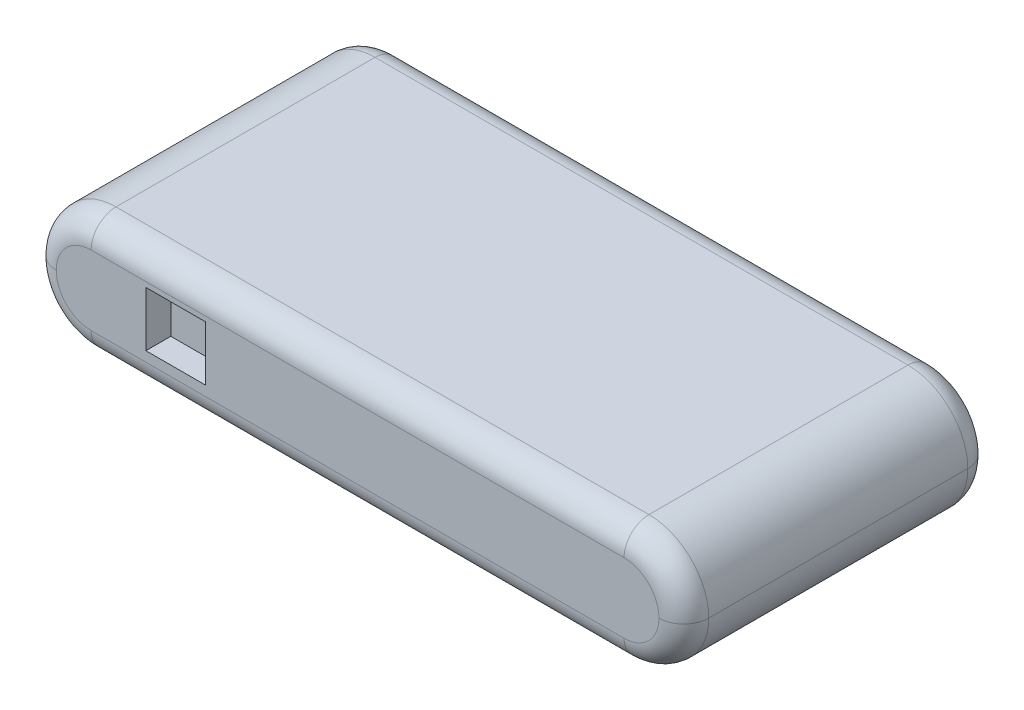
SolidWorks part; units mm, degrees
ref_plane "Front Plane" through (0, 0, 0) normal (0, 0, 1) x (1, 0, 0)
ref_plane "Top Plane" through (0, 0, 0) normal (0, 1, 0) x (1, 0, 0)
ref_plane "Right Plane" through (0, 0, 0) normal (1, 0, 0) x (0, 0, -1)
sketch "Sketch1" plane through (0, 0, 0) normal (0, 1, 0) x (1, 0, 0)
  line L1 (-65.5, -31) -> (65.5, -31)
  line L2 (-65.5, -31) -> (-65.5, 31)
  line L3 (-65.5, 31) -> (65.5, 31)
  line L4 (65.5, -31) -> (65.5, 31)
  line L5 (-65.5, -31) -> (65.5, 31) construction
  line L6 (-65.5, 31) -> (65.5, -31) construction
  point P0 (0, 0)
  dimension "D1" = 131
  dimension "D2" = 62
extrude "Boss-Extrude1" add sketch "Sketch1" along normal blind 24
fillet "Fillet2" radius 12 4 edges at (65.5, 24, 0) (65.5, 0, 0) (-65.5, 0, 0) (-65.5, 24, 0)
fillet "Fillet1" radius 5 12 edges at (0, 0, -31) (0, 0, 31) (0, 24, -31) (0, 24, 31) (61.9853, 20.4853, -31) (61.9853, 3.5147, -31) (-61.9853, 3.5147, -31) (-61.9853, 20.4853, -31) (-61.9853, 20.4853, 31) (-61.9853, 3.5147, 31) (61.9853, 3.5147, 31) (61.9853, 20.4853, 31)
sketch "Sketch2" plane through (0, 0, 31) normal (0, 0, 1) x (1, 0, 0)
  line L5 (53.5, 0) -> (-53.5, 0) construction
  line L6 (-42.5, 18) -> (-30.5, 18)
  line L7 (-42.5, 18) -> (-42.5, 7)
  line L8 (-42.5, 7) -> (-30.5, 7)
  line L9 (-30.5, 18) -> (-30.5, 7)
  line L10 (-53.5, 24) -> (53.5, 24) construction
  dimension "D1" = 7
  dimension "D2" = 6
  dimension "D3" = 12
  dimension "D4" = 23
extrude "Cut-Extrude1" cut sketch "Sketch2" against normal blind 5
sketch "Sketch3" plane through (0, 0, -31) normal (0, 0, -1) x (-1, 0, 0)
  line L0 (53.5, 0) -> (-53.5, 0) construction
  circle A0 centre (-37.5, 13) radius 1.75
  circle A1 centre (-22.5, 13) radius 1.75
  circle A2 centre (-7.5, 13) radius 1.75
  circle A3 centre (7.5, 13) radius 1.75
  circle A4 centre (22.5, 13) radius 1.75
  circle A5 centre (37.5, 13) radius 1.75
  dimension "D1" = 3.5
  dimension "D2" = 13
  dimension "D3" = 28
  dimension "D4" = 6
extrude "Cut-Extrude2" cut sketch "Sketch3" against normal blind 5
